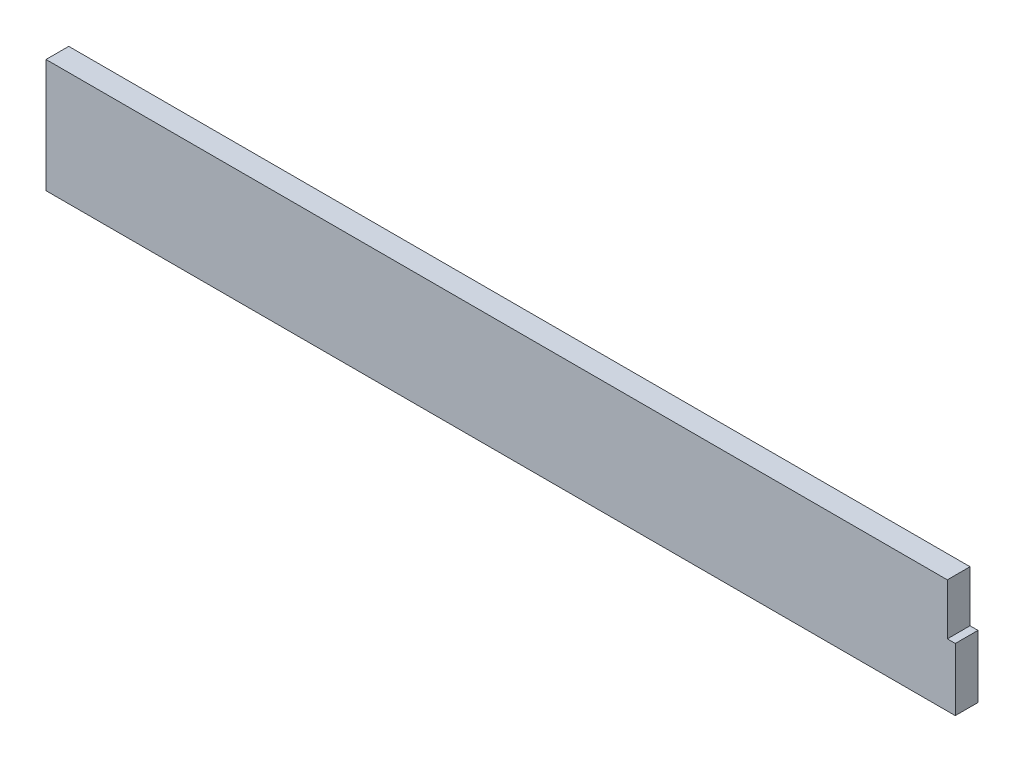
SolidWorks part; units mm, degrees
ref_plane "前视基准面" through (0, 0, 0) normal (0, 0, 1) x (1, 0, 0)
ref_plane "上视基准面" through (0, 0, 0) normal (0, 1, 0) x (1, 0, 0)
ref_plane "右视基准面" through (0, 0, 0) normal (1, 0, 0) x (0, 0, -1)
sketch "草图1" plane through (0, 0, 0) normal (0, 0, 1) x (1, 0, 0)
  line L0 (0, 0) -> (80, 0)
  line L1 (0, 10) -> (79.3, 10)
  line L2 (79.3, 5.5) -> (80, 5.5)
  line L3 (80, 0) -> (80, 5.5)
  line L4 (0, 0) -> (0, 10)
  line L5 (79.3, 5.5) -> (79.3, 10)
extrude "凸台-拉伸1" add sketch "草图1" along normal blind 2
